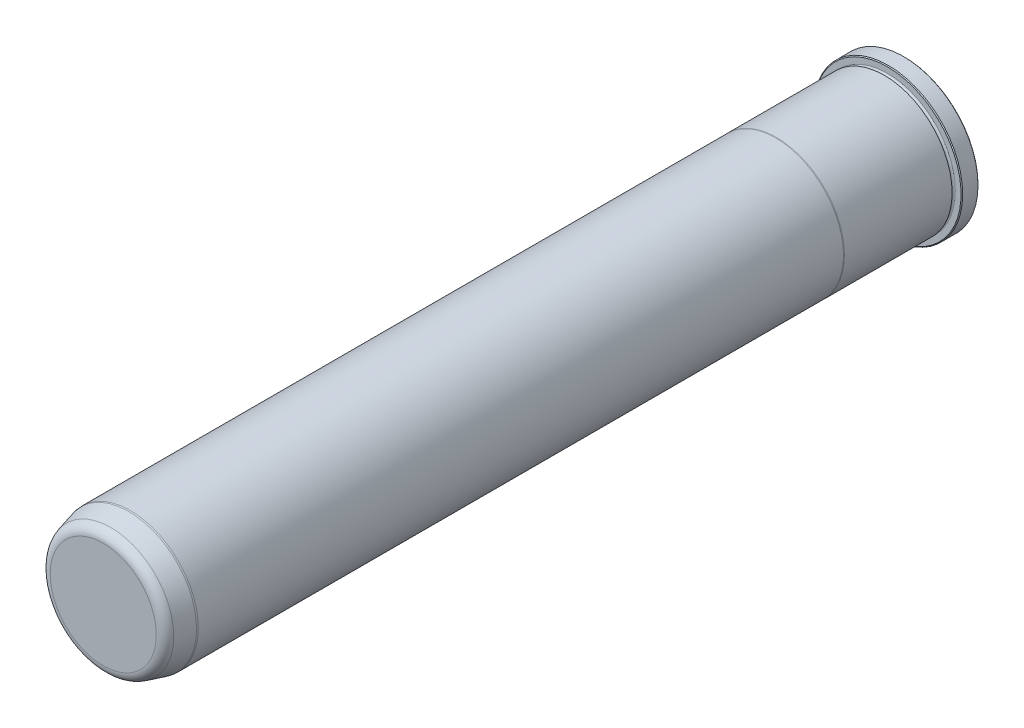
SolidWorks part; units mm, degrees
ref_plane "Front Plane" through (0, 0, 0) normal (0, 0, 1) x (1, 0, 0)
ref_plane "Top Plane" through (0, 0, 0) normal (0, 1, 0) x (1, 0, 0)
ref_plane "Right Plane" through (0, 0, 0) normal (1, 0, 0) x (0, 0, -1)
sketch "Sketch1" plane through (0, 0, 0) normal (1, 0, 0) x (0, 0, -1)
  line L0 (0, 0) -> (0, 34.798)
  line L1 (0, 34.798) -> (-7.9248, 34.798)
  line L2 (-7.9248, 34.798) -> (-7.9248, 31.7373)
  line L3 (-7.9248, 30.9753) -> (-9.4488, 30.9753) construction
  line L4 (-9.4488, 31.7373) -> (-9.4488, 31.7627)
  line L5 (-9.4488, 31.7627) -> (-59.8348, 31.7627)
  line L6 (-59.8348, 31.7627) -> (-60.198, 31.7373)
  line L7 (-60.198, 31.7373) -> (-361.95, 31.7373)
  line L9 (-374.65, 28.4719) -> (-374.65, 0)
  line L10 (-374.65, 0) -> (0, 0)
  line L11 (0, 0) -> (13.6287, 0) construction
  line L12 (-361.95, 31.7373) -> (-362.712, 31.6706)
  line L13 (-362.712, 31.6706) -> (-374.65, 28.4719)
  arc A0 (-9.4488, 31.7373) -> (-7.9248, 31.7373) centre (-8.6868, 31.7373) ccw
  dimension "D14" = 1.524
  dimension "D1" = 7.9248
  dimension "D2" = 1.524
  dimension "D3" = 69.596
  dimension "D4" = 63.5254
  dimension "D5" = 60.198
  dimension "D6" = 374.65
  dimension "D7" = 0.7874
  dimension "D8" = 4
  dimension "D9" = 63.4746
  dimension "D10" = 5
  dimension "D11" = 15
  dimension "D12" = 0.762
  dimension "D13" = 12.7
revolve "Revolve1" add sketch "Sketch1" angle 360 about L11
fillet "Fillet6" radius 4.7625 1 edges at (28.4719, 0, 374.65)
chamfer "Chamfer1" distance 0.381 angle 45 2 edges at (34.798, 0, 0) (34.798, 0, 7.9248)
